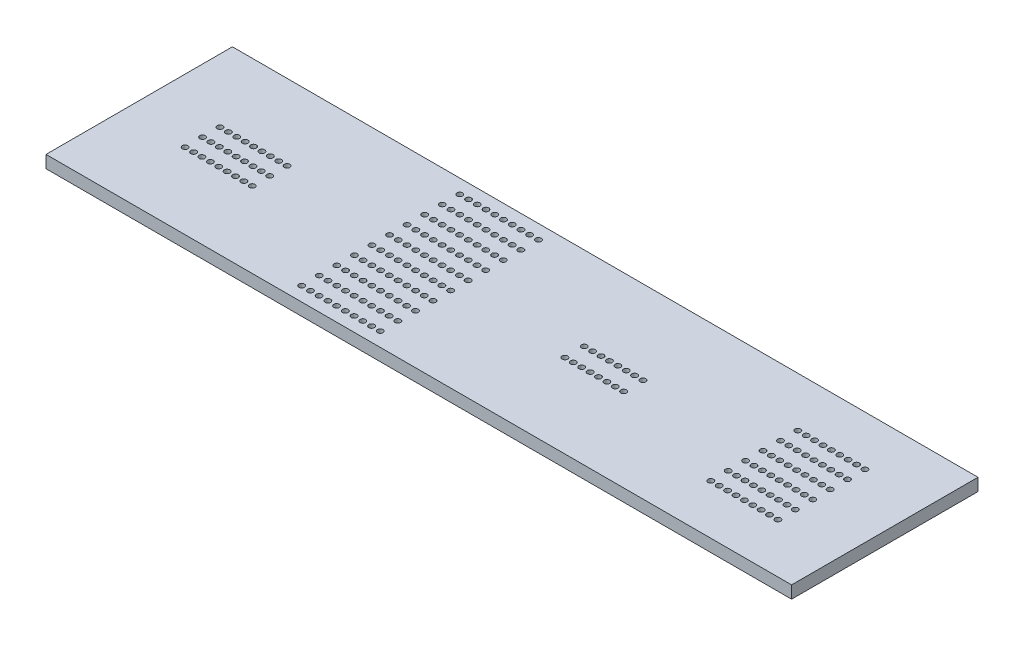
SolidWorks part; units mm, degrees
ref_plane "Plan de face" through (0, 0, 0) normal (0, 0, 1) x (1, 0, 0)
ref_plane "Plan de dessus" through (0, 0, 0) normal (0, 1, 0) x (1, 0, 0)
ref_plane "Plan de droite" through (0, 0, 0) normal (1, 0, 0) x (0, 0, -1)
sketch "Esquisse2" plane through (0, 0, 0) normal (0, 1, 0) x (1, 0, 0)
  line L1 (-60, -15) -> (60, -15)
  line L2 (-60, -15) -> (-60, 15)
  line L3 (-60, 15) -> (60, 15)
  line L4 (60, -15) -> (60, 15)
  line L5 (-60, -15) -> (60, 15) construction
  line L6 (-60, 15) -> (60, -15) construction
  point P0 (0, 0)
  dimension "D1" = 30
  dimension "D2" = 120
extrude "Boss.-Extru.1" add sketch "Esquisse2" along normal blind 2 contours L3 L4 L1 L2
sketch "Cavités" plane through (0, 0, 0) normal (0, 1, 0) x (1, 0, 0)
  line L0 (-60, -15) -> (60, -15) construction
  line L1 (-58.4, 15) -> (-30.4, 15) construction
  line L2 (-58.4, 15) -> (-58.4, -15) construction
  line L3 (-58.4, -15) -> (-30.4, -15) construction
  line L4 (-30.4, 15) -> (-30.4, -15) construction
  line L5 (-60, 15) -> (60, 15) construction
  line L6 (-28.8, 15) -> (-0.8, 15) construction
  line L7 (-28.8, 15) -> (-28.8, -15) construction
  line L8 (-28.8, -15) -> (-0.8, -15) construction
  line L9 (-0.8, 15) -> (-0.8, -15) construction
  line L10 (-30.4, 15) -> (-28.8, 15) construction
  line L11 (0.8, 15) -> (28.8, 15) construction
  line L12 (0.8, 15) -> (0.8, -15) construction
  line L13 (0.8, -15) -> (28.8, -15) construction
  line L14 (28.8, 15) -> (28.8, -15) construction
  line L15 (30.4, 15) -> (58.4, 15) construction
  line L16 (30.4, 15) -> (30.4, -15) construction
  line L17 (30.4, -15) -> (58.4, -15) construction
  line L18 (58.4, 15) -> (58.4, -15) construction
  line L19 (-0.8, 15) -> (0.8, 15) construction
  line L20 (28.8, 15) -> (30.4, 15) construction
  line L21 (-60, 15) -> (-58.4, 15) construction
  line L22 (58.4, 15) -> (60, 15) construction
  dimension "D1" = 28
  dimension "D2" = 1.6
sketch "Esquisse7" plane through (0, 2, 0) normal (0, 1, 0) x (1, 0, 0)
  line L0 (-58.4, 0) -> (-49.8, 0) construction
  line L1 (-49.8, 2.8) -> (-39, 2.8) construction
  line L2 (-49.8, 2.8) -> (-49.8, -2.8) construction
  line L3 (-49.8, -2.8) -> (-39, -2.8) construction
  line L4 (-39, 2.8) -> (-39, -2.8) construction
  line L5 (-58.4, 15) -> (-58.4, -15) construction
  line L6 (-39, 0) -> (-30.4, 0) construction
  line L7 (-30.4, 15) -> (-30.4, -15) construction
  dimension "D1" = 10.8
  dimension "D2" = 5.6
sketch "Esquisse8" plane through (0, 2, 0) normal (0, 1, 0) x (1, 0, 0)
  circle A0 centre (-49.8, 2.8) radius 0.45
  dimension "D1" = 0.9
extrude "Enlèv. mat.-Extru.3" cut sketch "Esquisse8" against normal up to next
pattern_linear "Répétition linéaire4" count 9 spacing 1.35 along (1, 0, 0) count 3 spacing 2.8 along (0, 0, 1) of "Enlèv. mat.-Extru.3"
sketch "Esquisse9" plane through (0, 2, 0) normal (0, 1, 0) x (1, 0, 0)
  line L0 (-28.8, 0) -> (-21.127, 0) construction
  line L1 (-21.127, 12.725) -> (-8.473, 12.725) construction
  line L2 (-21.127, 12.725) -> (-21.127, -12.725) construction
  line L3 (-21.127, -12.725) -> (-8.473, -12.725) construction
  line L4 (-8.473, 12.725) -> (-8.473, -12.725) construction
  line L5 (-28.8, 15) -> (-28.8, -15) construction
  line L6 (-8.473, 0) -> (-0.8, 0) construction
  line L7 (-0.8, 15) -> (-0.8, -15) construction
  dimension "D1" = 12.654
  dimension "D2" = 25.45
sketch "Esquisse10" plane through (0, 2, 0) normal (0, 1, 0) x (1, 0, 0)
  circle A0 centre (-21.127, 12.725) radius 0.45
  dimension "D1" = 0.9
extrude "Enlèv. mat.-Extru.4" cut sketch "Esquisse10" against normal up to next
pattern_linear "Répétition linéaire5" count 10 spacing 1.406 along (1, 0, 0) count 10 spacing 2.8278 along (0, 0, 1) of "Enlèv. mat.-Extru.4"
sketch "Esquisse11" plane through (0, 2, 0) normal (0, 1, 0) x (1, 0, 0)
  line L0 (0.8, 0) -> (10.075, 0) construction
  line L1 (10.075, 1.5555) -> (19.525, 1.5555) construction
  line L2 (10.075, 1.5555) -> (10.075, -1.5555) construction
  line L3 (10.075, -1.5555) -> (19.525, -1.5555) construction
  line L4 (19.525, 1.5555) -> (19.525, -1.5555) construction
  line L5 (0.8, 15) -> (0.8, -15) construction
  line L6 (19.525, 0) -> (28.8, 0) construction
  line L7 (28.8, 15) -> (28.8, -15) construction
  dimension "D1" = 9.45
  dimension "D2" = 3.111
sketch "Esquisse12" plane through (0, 2, 0) normal (0, 1, 0) x (1, 0, 0)
  circle A0 centre (10.075, 1.5555) radius 0.45
  dimension "D1" = 0.9
extrude "Enlèv. mat.-Extru.5" cut sketch "Esquisse12" against normal up to next
pattern_linear "Répétition linéaire6" count 8 spacing 1.35 along (1, 0, 0) count 2 spacing 3.111 along (0, 0, 1) of "Enlèv. mat.-Extru.5"
sketch "Esquisse13" plane through (0, 2, 0) normal (0, 1, 0) x (1, 0, 0)
  line L0 (30.4, 0) -> (39, 0) construction
  line L1 (39, 7) -> (49.8, 7) construction
  line L2 (39, 7) -> (39, -7) construction
  line L3 (39, -7) -> (49.8, -7) construction
  line L4 (49.8, 7) -> (49.8, -7) construction
  line L5 (30.4, 15) -> (30.4, -15) construction
  line L6 (49.8, 0) -> (58.4, 0) construction
  line L7 (58.4, 15) -> (58.4, -15) construction
  dimension "D1" = 14
  dimension "D2" = 10.8
sketch "Esquisse14" plane through (0, 2, 0) normal (0, 1, 0) x (1, 0, 0)
  circle A0 centre (39, 7) radius 0.45
  dimension "D1" = 0.9
extrude "Enlèv. mat.-Extru.6" cut sketch "Esquisse14" against normal up to next
pattern_linear "Répétition linéaire7" count 9 spacing 1.35 along (1, 0, 0) count 6 spacing 2.8 along (0, 0, 1) of "Enlèv. mat.-Extru.6"
